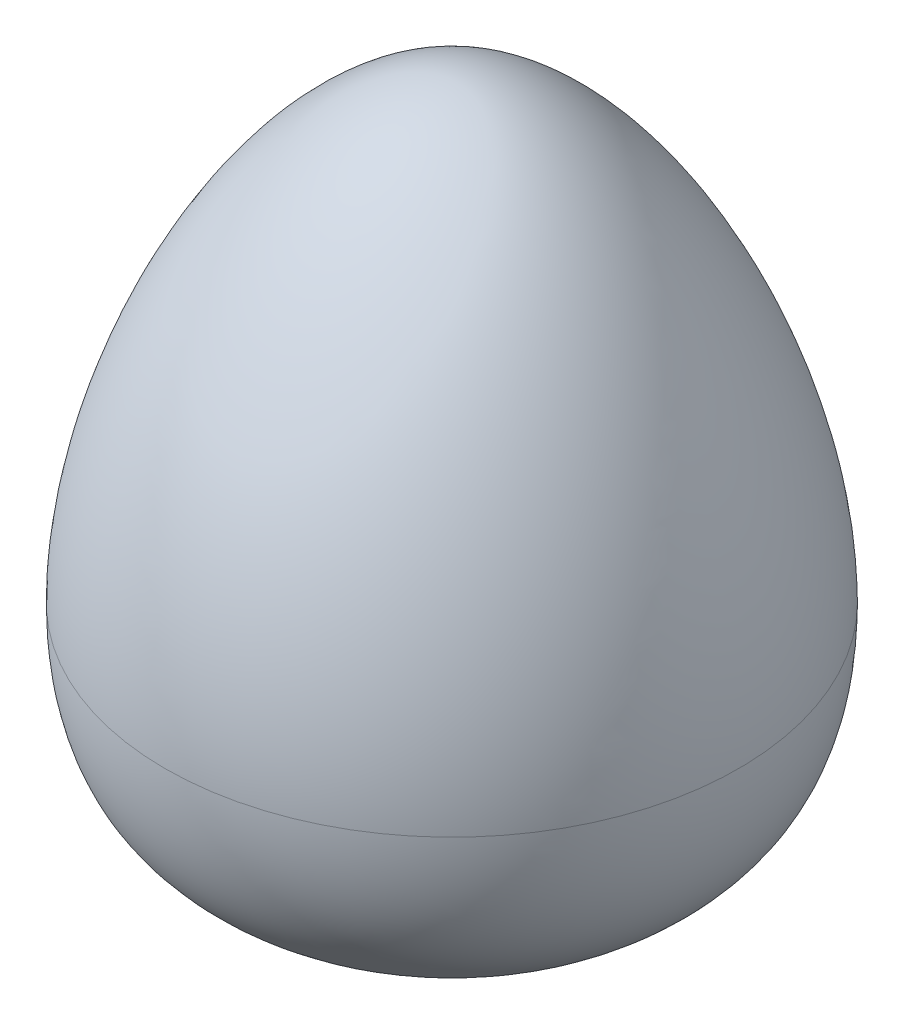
SolidWorks part; units mm, degrees
ref_plane "Front Plane" through (0, 0, 0) normal (0, 0, 1) x (1, 0, 0)
ref_plane "Top Plane" through (0, 0, 0) normal (0, 1, 0) x (1, 0, 0)
ref_plane "Right Plane" through (0, 0, 0) normal (1, 0, 0) x (0, 0, -1)
sketch "Sketch1" plane through (0, 0, 0) normal (0, 0, 1) x (1, 0, 0)
  line L0 (0, 0) -> (0, 77.0434) construction
  line L1 (-26.2508, 77.0434) -> (26.2508, 77.0434) construction
  line L2 (8.1238, 0) -> (-8.1304, 0) construction
  line L3 (0, 0) -> (0, 77.0434) construction
  line L4 (0, 0) -> (0, 77.0434)
  spline S0 degree 3 poles (0, 77.0434) (-20.0029, 77.0434) (-50.248, 8.8022) (-9.9801, 0) (0, 0) knots 0 0 0 0 0.661391 1 1 1 1
revolve "Revolve1" add sketch "Sketch1" angle 360 about L4
